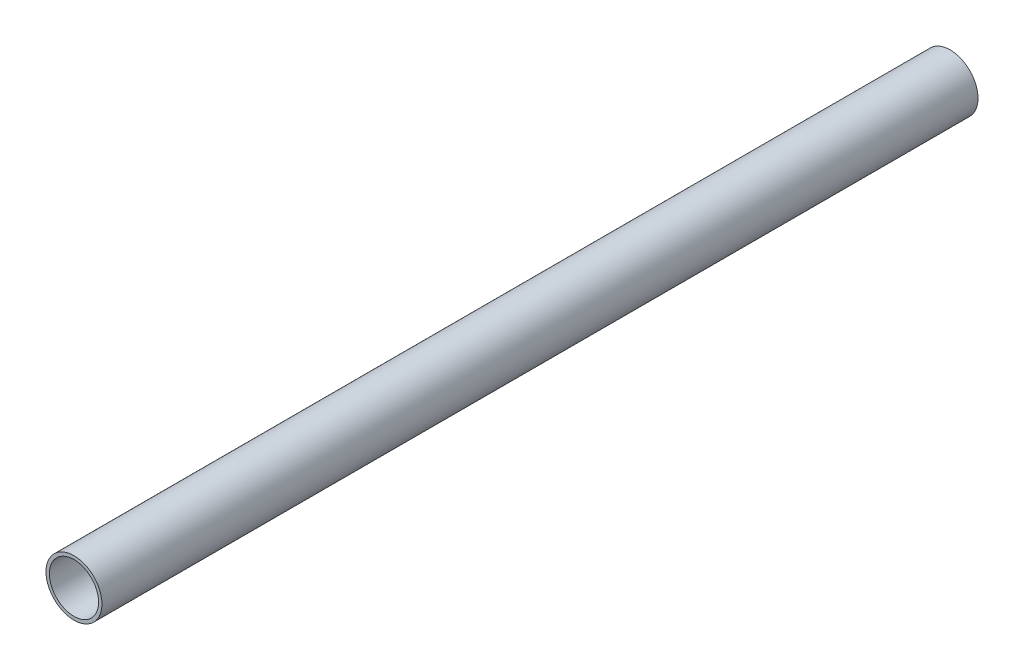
SolidWorks part; units mm, degrees
ref_plane "Front Plane" through (0, 0, 0) normal (0, 0, 1) x (1, 0, 0)
ref_plane "Top Plane" through (0, 0, 0) normal (0, 1, 0) x (1, 0, 0)
ref_plane "Right Plane" through (0, 0, 0) normal (1, 0, 0) x (0, 0, -1)
imported_body "Imported1"
sketch "Sketch1" plane through (0, 0, -717.4562) normal (0, 0, -1) x (-1, 0, 0)
  circle A0 centre (0, 0) radius 25 construction
  circle A1 centre (0, 0) radius 22 construction
  circle A2 centre (0, 0) radius 25
  circle A3 centre (0, 0) radius 22
extrude "Boss-Extrude1" add sketch "Sketch1" along normal blind 35.052
ref_plane "Plane1" [suppressed] through (0, 0, -209.5822) normal (0, 0, 1) x (1, 0, 0)
sketch "Sketch2" plane through (0, 0, -752.5082) normal (0, 0, -1) x (-1, 0, 0)
  circle A1 centre (0, 0) radius 25
  circle A2 centre (0, 0) radius 25
  dimension "D1" = 0
extrude "Cut-Extrude1" cut sketch "Sketch2" against normal blind 302.7426
ref_plane "Plane2" through (0, 0, -58.2109) normal (0, 0, 1) x (1, 0, 0)
